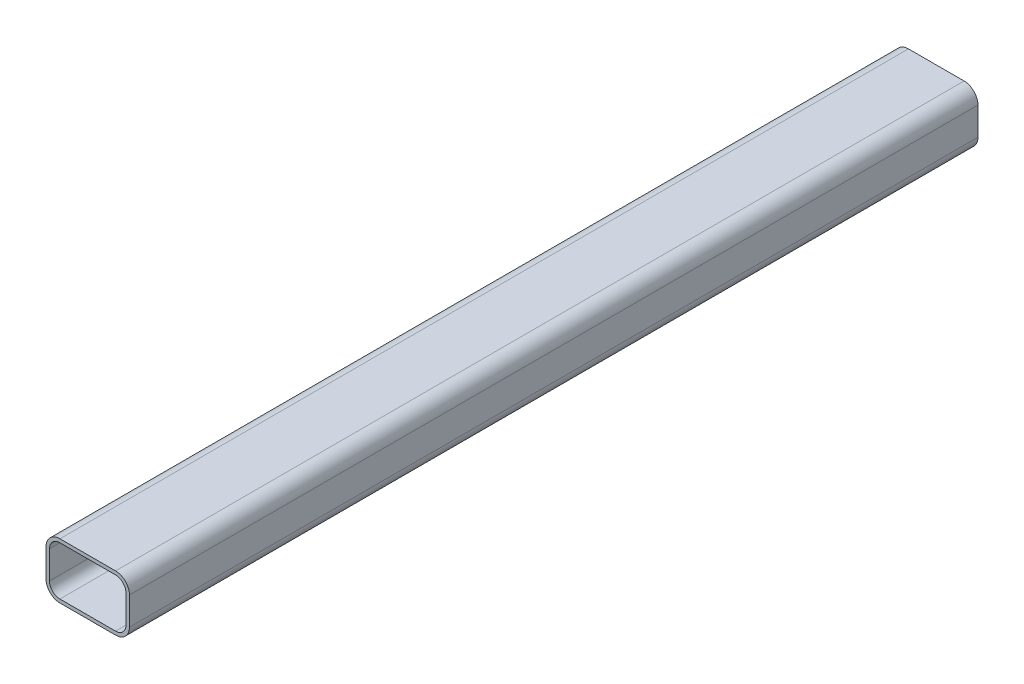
SolidWorks part; units mm, degrees
ref_plane "Plane1" through (0, 0, 0) normal (0, 0, 1) x (1, 0, 0)
ref_plane "Plane2" through (0, 0, 0) normal (0, 1, 0) x (1, 0, 0)
ref_plane "Plane3" through (0, 0, 0) normal (1, 0, 0) x (0, 0, -1)
sketch "Sketch1"
  dimension "D1" = 12.7
  dimension "D2" = 12.7
  dimension "D3" = 12.7
  dimension "D4" = 12.7
  dimension "D5" = 76.2
  dimension "D6" = 50.8
  dimension "D7" = 12.7
extrude "Base-Extrude-Thin" add sketch "Sketch1" along normal mid plane 774.7 thin
